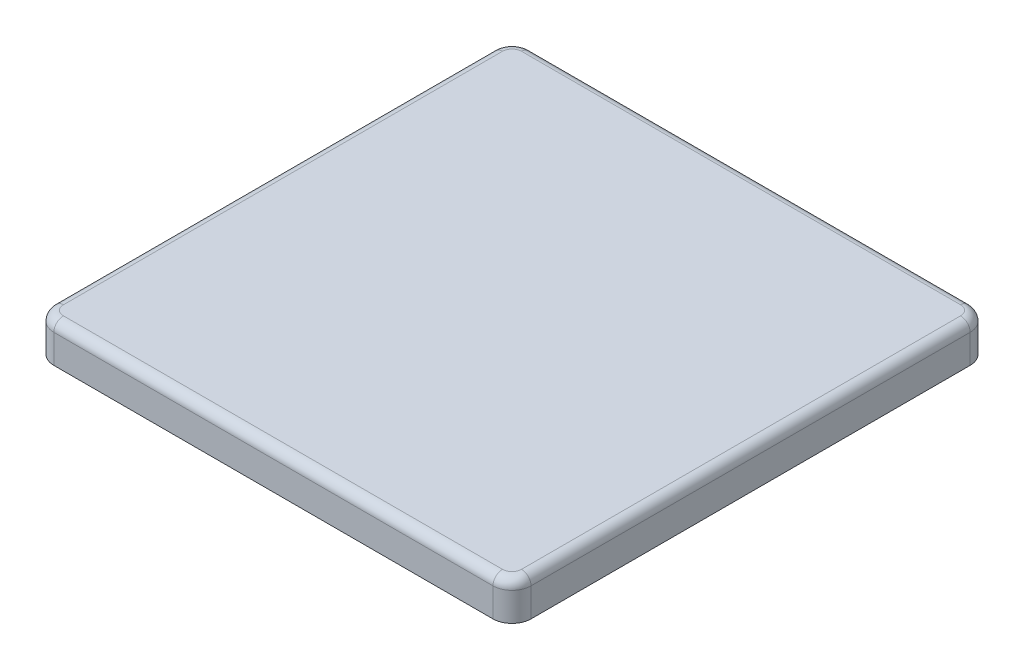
SolidWorks part; units mm, degrees
ref_plane "正面" through (0, 0, 0) normal (0, 0, 1) x (1, 0, 0)
ref_plane "平面" through (0, 0, 0) normal (0, 1, 0) x (1, 0, 0)
ref_plane "右側面" through (0, 0, 0) normal (1, 0, 0) x (0, 0, -1)
sketch "ｽｹｯﾁ1" plane through (0, 0, 0) normal (0, 1, 0) x (0, 0, -1)
  line L1 (-23, 25) -> (23, 25)
  line L2 (-25, 23) -> (-25, -23)
  line L3 (-23, -25) -> (23, -25)
  line L4 (25, 23) -> (25, -23)
  arc A0 (25, 23) -> (23, 25) centre (23, 23) ccw
  arc A1 (23, -25) -> (25, -23) centre (23, -23) ccw
  arc A2 (-25, -23) -> (-23, -25) centre (-23, -23) ccw
  arc A3 (-23, 25) -> (-25, 23) centre (-23, 23) ccw
  point P7 (25, 25)
  point P10 (25, -25)
  point P15 (-25, 25)
  dimension "D5" = 2
  dimension "D1" = 25
  dimension "D2" = 50
  dimension "D3" = 25
  dimension "D4" = 50
extrude "押し出し1" add sketch "ｽｹｯﾁ1" along normal mid plane 4
fillet "ﾌｨﾚｯﾄ1" radius 1 8 edges at (-24.4142, 2, 24.4142) (-25, 2, 0) (-24.4142, 2, -24.4142) (0, 2, -25) (24.4142, 2, -24.4142) (25, 2, 0) (24.4142, 2, 24.4142) (0, 2, 25)
sketch "ｽｹｯﾁ2" plane through (0, -2, 0) normal (0, -1, 0) x (1, 0, 0)
  line L1 (-22.2, 23) -> (22.2, 23)
  line L2 (-23, 22.2) -> (-23, -22.2)
  line L3 (-22.2, -23) -> (22.2, -23)
  line L4 (23, 22.2) -> (23, -22.2)
  arc A0 (-22.2, 23) -> (-23, 22.2) centre (-22.2, 22.2) ccw
  arc A1 (23, 22.2) -> (22.2, 23) centre (22.2, 22.2) ccw
  arc A2 (22.2, -23) -> (23, -22.2) centre (22.2, -22.2) ccw
  arc A3 (-23, -22.2) -> (-22.2, -23) centre (-22.2, -22.2) ccw
  point P7 (-23, 23)
  point P10 (23, 23)
  point P13 (23, -23)
  dimension "D5" = 0.8
  dimension "D1" = 23
  dimension "D2" = 46
  dimension "D3" = 23
  dimension "D4" = 46
extrude "押し出し2" cut sketch "ｽｹｯﾁ2" against normal blind 2
sketch "ｽｹｯﾁ3" plane through (0, 0, 0) normal (0, -1, 0) x (1, 0, 0)
  line L0 (-23, 22.2) -> (-23, -22.2) construction
  line L1 (-23, 4) -> (-21.2, 4)
  line L2 (-23, 4) -> (-23, -4)
  line L3 (-23, -4) -> (-21.2, -4)
  line L4 (-21.2, 4) -> (-21.2, -4)
  line L5 (23, -25) -> (-23, -25) construction
  dimension "D1" = 8
  dimension "D2" = 1.8
  dimension "D3" = 1.8
  dimension "D4" = 21
extrude "押し出し3" add sketch "ｽｹｯﾁ3" along normal blind 4
sketch "ｽｹｯﾁ4" plane through (0, 0, 0) normal (0, -1, 0) x (1, 0, 0)
  line L1 (-3.7477, 0.7071) -> (-0.7071, 3.7477)
  line L2 (-3.7477, 0.7071) -> (0.7071, -3.7477)
  line L3 (0.7071, -3.7477) -> (3.7477, -0.7071)
  line L4 (-0.7071, 3.7477) -> (3.7477, -0.7071)
  dimension "D1" = 4.3
  dimension "D2" = 6.3
  dimension "D3" = 2.15
  dimension "D4" = 3.15
extrude "押し出し4" add sketch "ｽｹｯﾁ4" along normal blind 11 draft 0.5
fillet "ﾌｨﾚｯﾄ2" radius 0.8 4 edges at (-2.1595, -11, 2.1595) (1.4524, -11, 1.4524) (2.1595, -11, -2.1595) (-1.4524, -11, -1.4524)
